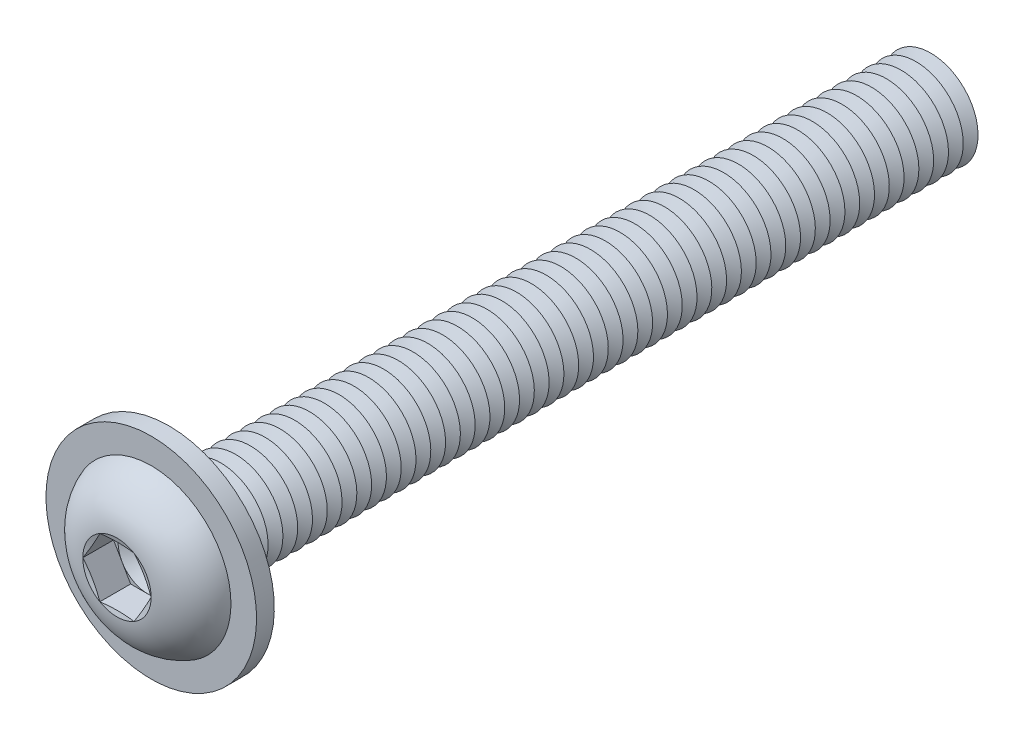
SolidWorks part; units mm, degrees
ref_plane "Front Plane" through (0, 0, 0) normal (0, 0, 1) x (1, 0, 0)
ref_plane "Top Plane" through (0, 0, 0) normal (0, 1, 0) x (1, 0, 0)
ref_plane "Right Plane" through (0, 0, 0) normal (1, 0, 0) x (0, 0, -1)
sketch "Sketch1" plane through (0, 0, 0) normal (1, 0, 0) x (0, 0, -1)
  line L0 (0, 4) -> (0, 7)
  line L3 (0, 4) -> (65, 4)
  line L4 (65, 4) -> (65, 0)
  line L5 (65, 0) -> (-4.4, 0) construction
  line L6 (-4.4, 0) -> (65, 0)
  line L7 (-4.4, 2.8867) -> (-4.4, 1.4434) construction
  line L8 (-4.4, 1.4434) -> (-4.4, 0)
  line L9 (-4.4, 2.8867) -> (-4.0132, 1.4434)
  line L10 (-4.0132, 1.4434) -> (-4.4, 1.4434)
  line L11 (65, 0) -> (22.7481, 0) construction
  line L12 (0, 7) -> (-4.4, 7) construction
  arc A1 (0, 7) -> (-4.4, 2.8867) centre (0, 2.59) ccw
  point P8 (65, 2)
  dimension "D1" = 14
  dimension "D2" = 8
  dimension "D3" = 4.4
  dimension "D4" = 5.7735
  dimension "D5" = 65
  dimension "D6" = 15
revolve "Revolve1" add sketch "Sketch1" angle 360 about L5
fillet "Fillet1" radius 0.625 1 edges at (0, 4, 0)
sketch "Sketch2" plane through (0, 0, 0) normal (1, 0, 0) x (0, 0, -1)
  line L0 (64.375, 4) -> (65.625, 4)
  line L1 (65, 4) -> (0.625, 4) construction
  line L2 (65.625, 4) -> (65, 2.9175)
  line L3 (65, -4) -> (65, 4) construction
  line L4 (65, 2.9175) -> (64.375, 4)
  dimension "D1" = 1.25
revolve "Cut-Revolve1" cut sketch "Sketch2" angle 360 about axis through (0, 0, -65) along (0, 0, -1)
pattern_linear "LPattern1" count 52 spacing 1.25 along (0, 0, 1) of "Cut-Revolve1"
sketch "Sketch3" plane through (0, 0, 4.4) normal (0, 0, 1) x (1, 0, 0)
  line L7 (1.4434, 2.5) -> (-1.4434, 2.5)
  line L8 (-1.4434, 2.5) -> (-2.8867, 0)
  line L9 (-2.8867, 0) -> (-1.4434, -2.5)
  line L10 (-1.4434, -2.5) -> (1.4434, -2.5)
  line L11 (1.4434, -2.5) -> (2.8867, 0)
  line L12 (2.8867, 0) -> (1.4434, 2.5)
  circle A0 centre (0, 0) radius 2.5 construction
  circle A3 centre (0, 0) radius 2.8867 construction
extrude "Cut-Extrude1" cut sketch "Sketch3" against normal blind 2.6
sketch "Sketch4" plane through (0, 0, 1.8) normal (0, 0, 1) x (1, 0, 0)
  line L1 (1.4434, 2.5) -> (-1.4434, 2.5) construction
  circle A0 centre (0, 0) radius 2.5
extrude "Cut-Extrude2" cut sketch "Sketch4" against normal through all draft 60
sketch "Sketch5" plane through (0, 0, 0) normal (0, 0, -1) x (-1, 0, 0)
  circle A0 centre (0, 0) radius 8.9
  circle A1 centre (0, 0) radius 4.625
  circle A2 centre (0, 0) radius 4.625 construction
  dimension "D1" = 17.8
extrude "Boss-Extrude1" add sketch "Sketch5" against normal blind 1.5
